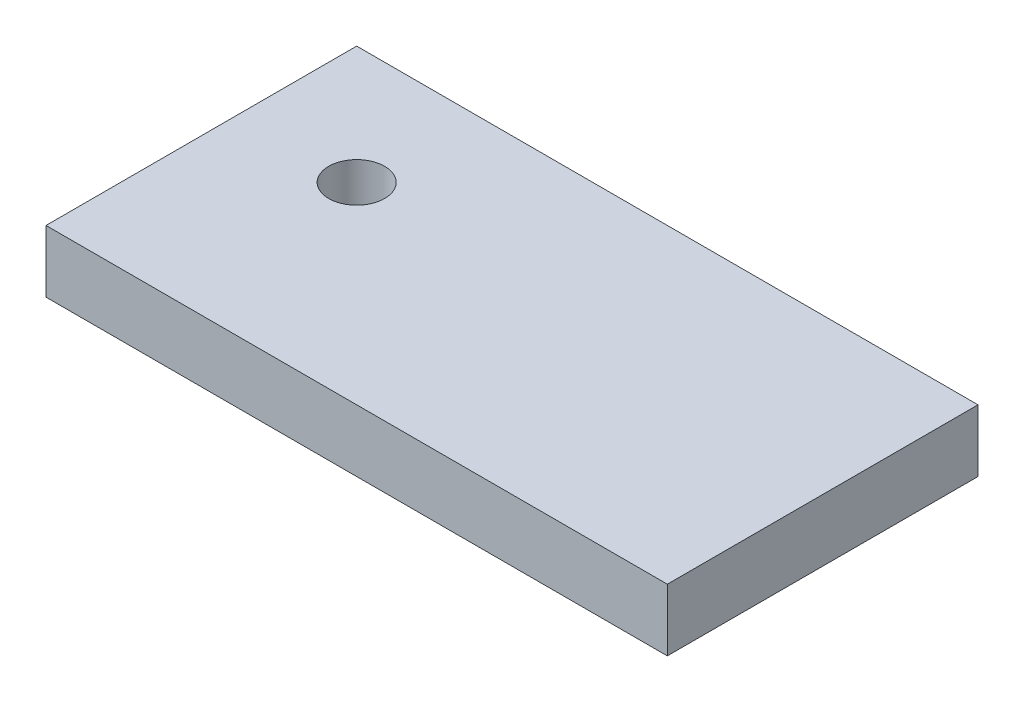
SolidWorks part; units mm, degrees
ref_plane "Front Plane" through (0, 0, 0) normal (0, 0, 1) x (1, 0, 0)
ref_plane "Top Plane" through (0, 0, 0) normal (0, 1, 0) x (1, 0, 0)
ref_plane "Right Plane" through (0, 0, 0) normal (1, 0, 0) x (0, 0, -1)
sketch "Sketch1" plane through (0, 0, 0) normal (0, 1, 0) x (1, 0, 0)
  line L1 (0, 0) -> (100, 0)
  line L2 (0, 0) -> (0, 50)
  line L3 (0, 50) -> (100, 50)
  line L4 (100, 0) -> (100, 50)
  dimension "D1" = 100
  dimension "D2" = 50
extrude "Extrude1" add sketch "Sketch1" along normal blind 10
hole_wizard " (9) Diameter Hole1" positions "3DSketch1" profile "Sketch2" hole size "Ø9.0" standard "Ansi Metric"
sketch3d "3DSketch1"
  line L0 (0, 10, -50) -> (0, 10, 0) construction
  line L1 (100, 10, -50) -> (0, 10, -50) construction
  point P0 (19, 10, -31)
  dimension "D1" = 19
  dimension "D2" = 19
sketch "Sketch2" plane through (19, 10, -31) normal (1, 0, 0) x (0, 0, 1)
  line L0 (0, 0) -> (0, 12.7039)
  line L1 (0, 12.7039) -> (4.5, 10)
  line L2 (4.5, 10) -> (4.5, 0)
  line L5 (4.5, 0) -> (0, 0)
  line L10 (0, 12.7039) -> (-4.5, 10) construction
  line L11 (0, -6.35) -> (0, 107.95) construction
  dimension "Hole Dia." = 9
  dimension "Hole Depth" = 10
  dimension "Drill Angle" = 118
